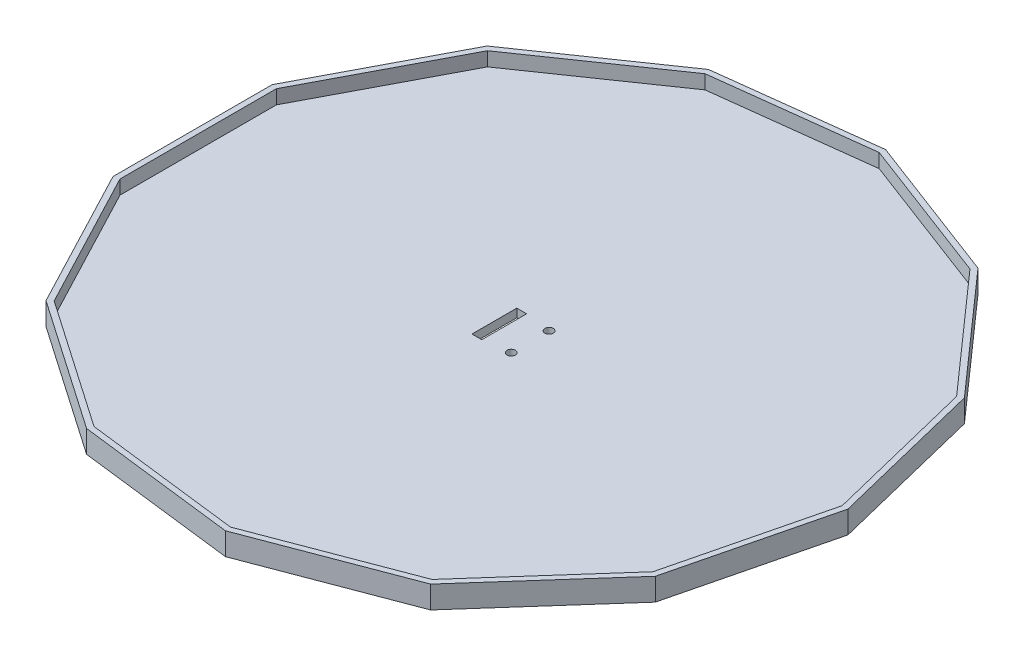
SolidWorks part; units mm, degrees
ref_plane "Front Plane" through (0, 0, 0) normal (0, 0, 1) x (1, 0, 0)
ref_plane "Top Plane" through (0, 0, 0) normal (0, 1, 0) x (1, 0, 0)
ref_plane "Right Plane" through (0, 0, 0) normal (1, 0, 0) x (0, 0, -1)
sketch "Sketch5" plane through (0, 0, 0) normal (0, 1, 0) x (1, 0, 0)
  line L46 (-88.7665, 78.6402) -> (-115.1448, 28.3806)
  line L50 (116.5309, 0) -> (103.183, 54.1546)
  line L51 (103.183, 54.1546) -> (66.1971, 95.9031)
  line L52 (66.1971, 95.9031) -> (14.0463, 115.6813)
  line L58 (14.0463, 115.6813) -> (-41.3224, 108.9583)
  line L59 (-41.3224, 108.9583) -> (-87.2247, 77.2743)
  line L60 (-87.2247, 77.2743) -> (-113.1448, 27.8877)
  line L61 (-113.1448, 27.8877) -> (-113.1448, -27.8877)
  line L62 (-113.1448, -27.8877) -> (-87.2247, -77.2743)
  line L63 (-87.2247, -77.2743) -> (-41.3224, -108.9583)
  line L64 (-41.3224, -108.9583) -> (14.0463, -115.6813)
  line L65 (14.0463, -115.6813) -> (66.1971, -95.9031)
  line L66 (66.1971, -95.9031) -> (103.183, -54.1546)
  line L67 (103.183, -54.1546) -> (116.5309, 0)
  line L68 (-115.1448, 28.3806) -> (-115.1448, -28.3806)
  line L69 (-115.1448, -28.3806) -> (-88.7665, -78.6402)
  line L70 (-88.7665, -78.6402) -> (-42.0529, -110.8843)
  line L71 (-42.0529, -110.8843) -> (14.2945, -117.7261)
  line L72 (14.2945, -117.7261) -> (67.3672, -97.5983)
  line L73 (67.3672, -97.5983) -> (105.0069, -55.1119)
  line L74 (105.0069, -55.1119) -> (118.5908, 0)
  line L75 (118.5908, 0) -> (105.0069, 55.1119)
  line L76 (105.0069, 55.1119) -> (67.3672, 97.5983)
  line L77 (67.3672, 97.5983) -> (14.2945, 117.7261)
  line L78 (14.2945, 117.7261) -> (-42.0529, 110.8843)
  line L79 (-42.0529, 110.8843) -> (-88.7665, 78.6402)
  line L80 (0, 0) -> (131.9845, 0) construction
  circle A0 centre (0, 0) radius 113.1448 construction
  point P1 (131.9845, 0)
  point P38 (0, 0)
  dimension "D1" = 113.1448
  dimension "D2" = 2
extrude "Walls of Enclosure" add sketch "Sketch5" along normal blind 8
sketch "Sketch7" plane through (0, 0, 0) normal (0, 1, 0) x (1, 0, 0)
  line L47 (14.2945, -117.7261) -> (67.3672, -97.5983)
  line L48 (-42.0529, 110.8843) -> (-88.7665, 78.6402)
  line L49 (-42.0529, 110.8843) -> (-88.7665, 78.6402)
  line L50 (-88.7665, 78.6402) -> (-115.1448, 28.3806)
  line L51 (-88.7665, 78.6402) -> (-115.1448, 28.3806)
  line L52 (-115.1448, 28.3806) -> (-115.1448, -28.3806)
  line L53 (14.2945, 117.7261) -> (-42.0529, 110.8843)
  line L54 (67.3672, 97.5983) -> (14.2945, 117.7261)
  line L55 (105.0069, 55.1119) -> (67.3672, 97.5983)
  line L56 (118.5908, 0) -> (105.0069, 55.1119)
  line L57 (105.0069, -55.1119) -> (118.5908, 0)
  line L58 (67.3672, -97.5983) -> (105.0069, -55.1119)
  line L59 (14.2945, -117.7261) -> (67.3672, -97.5983)
  line L65 (14.2945, 117.7261) -> (-42.0529, 110.8843)
  line L66 (67.3672, 97.5983) -> (14.2945, 117.7261)
  line L67 (105.0069, 55.1119) -> (67.3672, 97.5983)
  line L68 (118.5908, 0) -> (105.0069, 55.1119)
  line L69 (105.0069, -55.1119) -> (118.5908, 0)
  line L70 (67.3672, -97.5983) -> (105.0069, -55.1119)
  line L77 (-115.1448, 28.3806) -> (-115.1448, -28.3806)
  line L78 (-115.1448, -28.3806) -> (-88.7665, -78.6402)
  line L79 (-115.1448, -28.3806) -> (-88.7665, -78.6402)
  line L80 (-88.7665, -78.6402) -> (-42.0529, -110.8843)
  line L81 (-88.7665, -78.6402) -> (-42.0529, -110.8843)
  line L82 (-42.0529, -110.8843) -> (14.2945, -117.7261)
  line L83 (-42.0529, -110.8843) -> (14.2945, -117.7261)
  dimension "D1" = 0
extrude "Bottom of Enclosure" add sketch "Sketch7" along normal blind 3
sketch "Sketch11" plane through (0, 0, 0) normal (0, 1, 0) x (1, 0, 0)
  line L0 (-8, -9.5) -> (8, -9.5) construction
  line L1 (-8, -9.5) -> (-8, 9.5) construction
  line L2 (-8, 9.5) -> (8, 9.5) construction
  line L3 (8, -9.5) -> (8, 9.5) construction
  line L4 (-8, -9.5) -> (8, 9.5) construction
  line L5 (-8, 9.5) -> (8, -9.5) construction
  line L6 (-7.5, -8) -> (-4, -8)
  line L7 (-7.5, -8) -> (-7.5, 8)
  line L8 (-7.5, 8) -> (-4, 8)
  line L9 (-4, -8) -> (-4, 8)
  line L10 (-7.5, -8) -> (-4, 8) construction
  line L11 (-7.5, 8) -> (-4, -8) construction
  circle A0 centre (5.25, 6.75) radius 1.5
  circle A2 centre (5.25, -6.75) radius 1.5
  point P0 (0, 0)
  point P9 (-5.75, 0)
  point P14 (0, 0)
  dimension "D5" = 3
  dimension "D3" = 3
  dimension "D10" = 2.75
  dimension "D1" = 16
  dimension "D2" = 19
  dimension "D4" = 2.75
  dimension "D6" = 16
  dimension "D7" = 4
  dimension "D8" = 3.5
  dimension "D9" = 2.75
  dimension "D11" = 2.75
extrude "Sensor Holes" cut sketch "Sketch11" along normal through all
